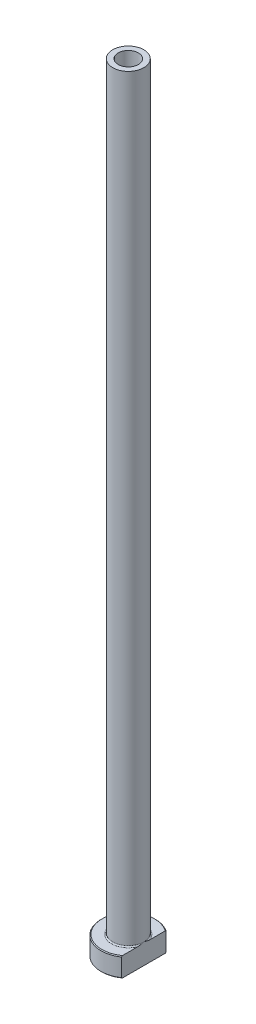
SolidWorks part; units mm, degrees
ref_plane "Front Plane" through (0, 0, 0) normal (0, 0, 1) x (1, 0, 0)
ref_plane "Top Plane" through (0, 0, 0) normal (0, 1, 0) x (1, 0, 0)
ref_plane "Right Plane" through (0, 0, 0) normal (1, 0, 0) x (0, 0, -1)
sketch "Sketch1" plane through (0, 0, 0) normal (0, 0, 1) x (1, 0, 0)
  line L0 (-2.6, 200) -> (-4, 200)
  line L1 (-4, 200) -> (-4, 5)
  line L2 (-4, 5) -> (-7, 5)
  line L3 (-7, 5) -> (-7, 0)
  line L4 (6.05, 0) -> (-6.05, 0) construction
  line L5 (-7, 0) -> (-2.85, 0)
  line L6 (-2.6, 155) -> (-2.6, 200)
  line L7 (0, 92.1877) -> (0, -15.5353) construction
  line L8 (0, -7.7) -> (0, 7.7) construction
  line L9 (-2.6, 155) -> (-2.85, 143)
  line L10 (-2.85, 143) -> (-2.85, 0)
  dimension "D1" = 0.25
  dimension "ID" = 5.2
  dimension "OD" = 8
  dimension "L" = 200
  dimension "H" = 14
  dimension "T" = 5
  dimension "N" = 45
  dimension "D2" = 12
  dimension "L-N" = 155
revolve "Revolve1" add sketch "Sketch1" angle 360 about L7
fillet "Fillet1" radius 0.3 1 edges at (0, 5, 4)
chamfer "Chamfer1" distance 0.2 angle 45 2 edges at (0, 5, 7) (0, 0, 7)
sketch "Sketch2" plane through (0, 0, 0) normal (0, -1, 0) x (1, 0, 0)
  line L0 (4, 5.7446) -> (4, -5.7446)
  circle A0 centre (0, 0) radius 7 construction
  arc A1 (4, 5.7446) -> (4, -5.7446) centre (0, 0) cw
  circle A2 centre (0, 0) radius 4 construction
extrude "Cut-Extrude1" cut sketch "Sketch2" against normal through all
chamfer "Chamfer2" distance 0.5 angle 45 1 edges at (0, 0, 2.85)
